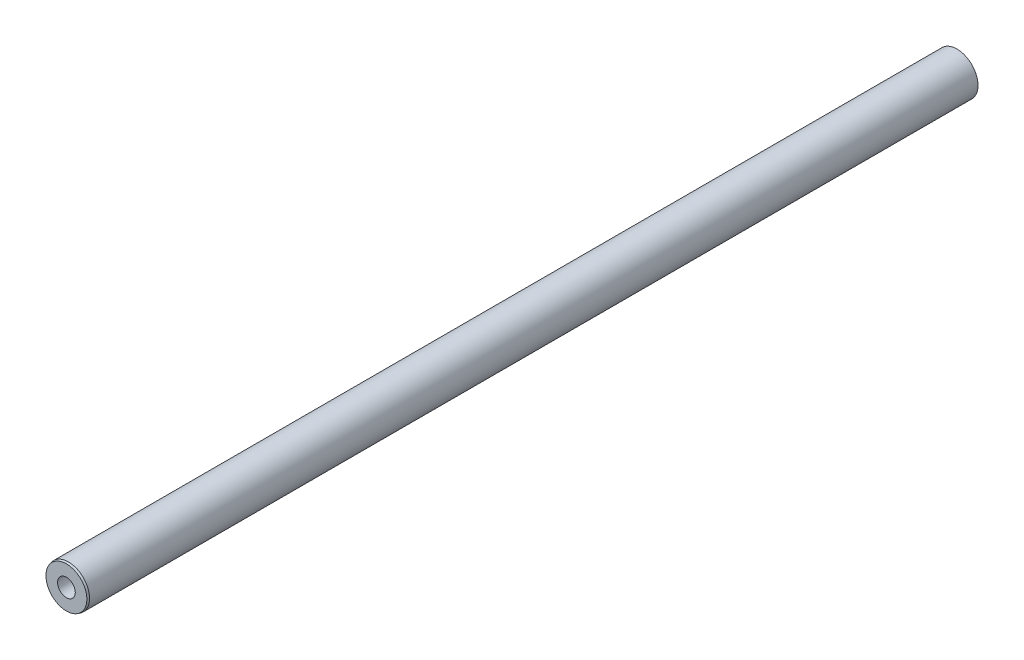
SolidWorks part; units mm, degrees
ref_plane "Front" through (0, 0, 0) normal (0, 0, 1) x (1, 0, 0)
ref_plane "Top" through (0, 0, 0) normal (0, 1, 0) x (1, 0, 0)
ref_plane "Right" through (0, 0, 0) normal (1, 0, 0) x (0, 0, -1)
sketch "Sketch1" plane through (0, 0, 0) normal (0, 0, 1) x (1, 0, 0)
  circle A0 centre (0, 0) radius 12.7
  dimension "D1" = 25.4
extrude "Base-Extrude" add sketch "Sketch1" along normal blind 538.2768
chamfer "Chamfer1" distance 1.27 angle 15 1 edges at (12.7, 0, 538.2768)
hole_wizard "1/2-13 Tapped Hole1" positions "Sketch3" profile "Sketch2"
sketch "Sketch3" plane through (0, 0, 538.2768) normal (0, 0, 1) x (1, 0, 0)
  point P0 (0, 0)
sketch "Sketch2" plane through (0, 0, 538.2768) normal (1, 0, 0) x (0, -1, 0)
  line L0 (0, 0) -> (0, 28.6195)
  line L1 (0, 28.6195) -> (5.3581, 25.4)
  line L2 (5.3581, 25.4) -> (5.3581, 0.0025)
  line L3 (5.3581, 0.0025) -> (5.3581, 0)
  line L5 (5.3581, 0) -> (0, 0)
  line L6 (-5.3581, 0.0025) -> (-5.3581, 0) construction
  line L10 (0, 28.6195) -> (-5.3581, 25.4) construction
  line L11 (0, -6.35) -> (0, 107.95) construction
